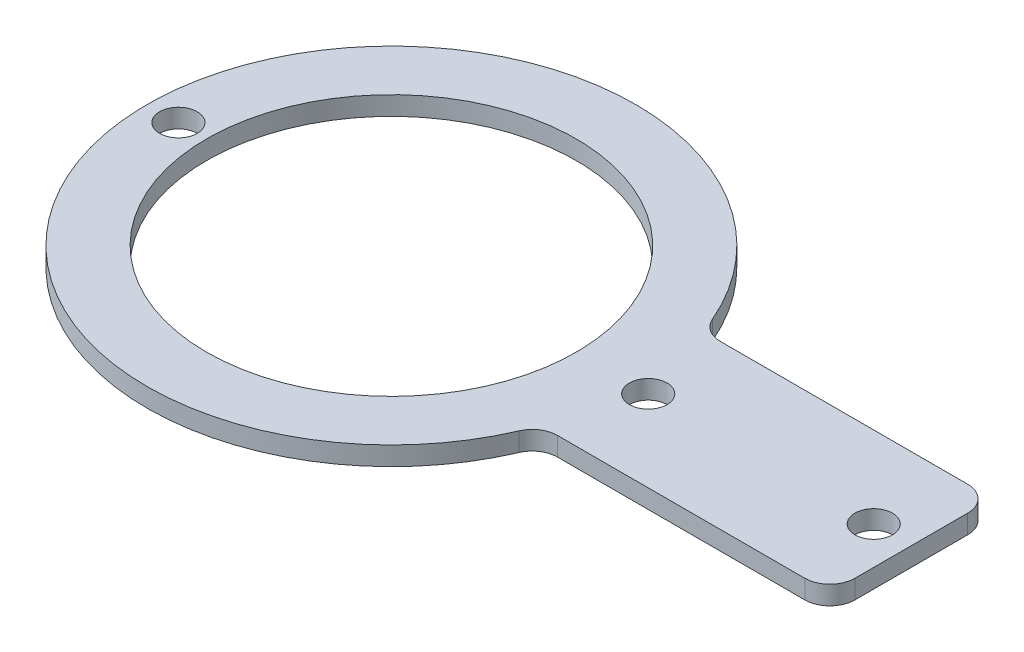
SolidWorks part; units mm, degrees
ref_plane "Спереди" through (0, 0, 0) normal (0, 0, 1) x (1, 0, 0)
ref_plane "Сверху" through (0, 0, 0) normal (0, 1, 0) x (1, 0, 0)
ref_plane "Справа" through (0, 0, 0) normal (1, 0, 0) x (0, 0, -1)
sketch "Эскиз1" plane through (0, 0, 0) normal (0, 1, 0) x (1, 0, 0)
  line L0 (40.5311, 6.2137) -> (41.5, 6.5) construction
  line L1 (19.7484, -6.5) -> (39.5, -6.5)
  line L3 (19.7484, 6.5) -> (39.5, 6.5)
  line L4 (41.5, -4.5) -> (41.5, 4.5)
  line L6 (40.5311, -6.2137) -> (41.5, -6.5) construction
  arc A0 (17.9114, 7.7093) -> (17.9114, -7.7093) centre (0, 0) ccw
  arc A1 (39.5, -6.5) -> (41.5, -4.5) centre (39.5, -4.5) ccw
  arc A2 (39.5, 6.5) -> (41.5, 4.5) centre (39.5, 4.5) cw
  arc A3 (19.7484, -6.5) -> (17.9114, -7.7093) centre (19.7484, -8.5) ccw
  arc A4 (19.7484, 6.5) -> (17.9114, 7.7093) centre (19.7484, 8.5) cw
  point P3 (19.5, 0)
  dimension "D1" = 13
  dimension "D3" = 2
  dimension "D2" = 2
extrude "Бобышка-Вытянуть1" add sketch "Эскиз1" along normal blind 1.5
sketch "Эскиз2" plane through (0, 1.5, 0) normal (0, 1, 0) x (1, 0, 0)
  circle A0 centre (0, 0) radius 14.75
extrude "Вырез-Вытянуть1" cut sketch "Эскиз2" against normal through all
sketch "Эскиз4" plane through (0, 1.5, 0) normal (0, 1, 0) x (1, 0, 0)
  line L0 (41.5, -4.5) -> (41.5, 4.5) construction
  circle A0 centre (-17, 0) radius 1.5
  circle A1 centre (20.5, 0) radius 1.5
  circle A2 centre (38.5, 0) radius 1.5
  arc A3 (17.9114, 7.7093) -> (17.9114, -7.7093) centre (0, 0) ccw construction
  dimension "D1" = 17
  dimension "D2" = 3
  dimension "D3" = 18
extrude "Вырез-Вытянуть3" cut sketch "Эскиз4" against normal through all
